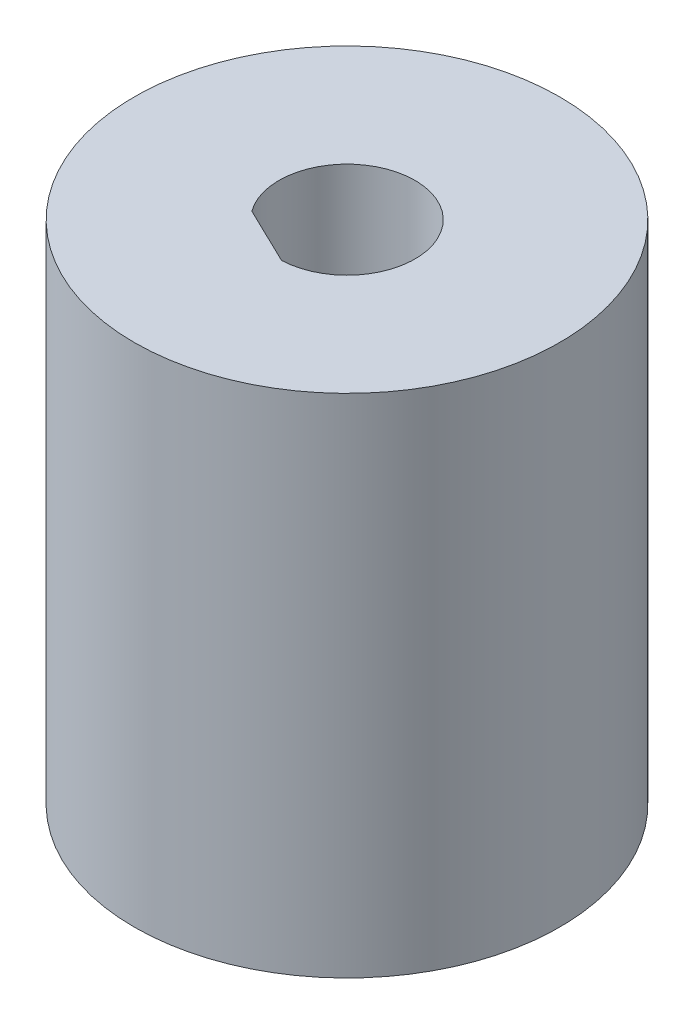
SolidWorks part; units mm, degrees
ref_plane "Front Plane" through (0, 0, 0) normal (0, 0, 1) x (1, 0, 0)
ref_plane "Top Plane" through (0, 0, 0) normal (0, 1, 0) x (1, 0, 0)
ref_plane "Right Plane" through (0, 0, 0) normal (1, 0, 0) x (0, 0, -1)
sketch "Sketch1" plane through (0, 0, 0) normal (0, 1, 0) x (1, 0, 0)
  circle A0 centre (0, 0) radius 5
  dimension "D1" = 10
extrude "Boss-Extrude1" add sketch "Sketch1" along normal blind 11.9
sketch "Sketch2" plane through (0, 11.9, 0) normal (0, 1, 0) x (1, 0, 0)
  line L0 (-1.2908, -0.9454) -> (0.0594, -1.5989)
  circle A0 centre (0, 0) radius 1.6
  dimension "D2" = 3.2
  dimension "D1" = 1.5
extrude "Cut-Extrude1" cut sketch "Sketch2" against normal through all contours L0 A0
